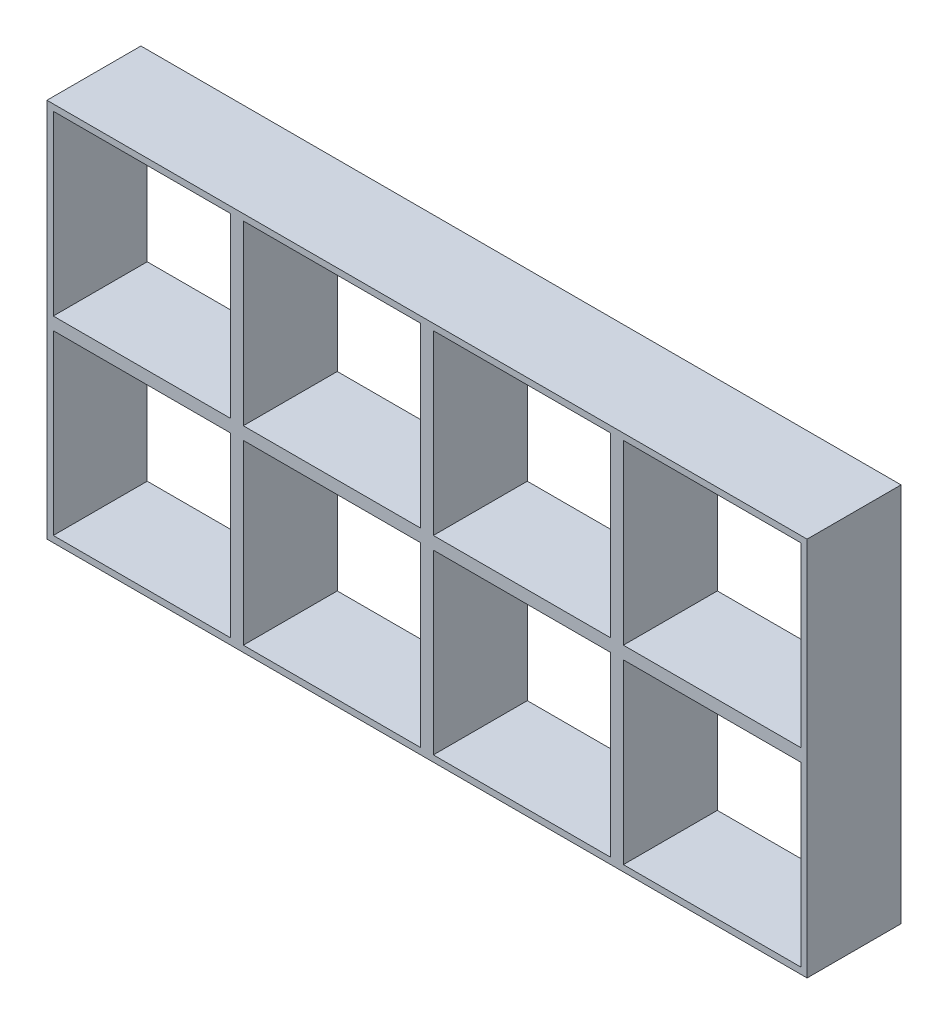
SolidWorks part; units mm, degrees
ref_plane "Plan de face" through (0, 0, 0) normal (0, 0, 1) x (1, 0, 0)
ref_plane "Plan de dessus" through (0, 0, 0) normal (0, 1, 0) x (1, 0, 0)
ref_plane "Plan de droite" through (0, 0, 0) normal (1, 0, 0) x (0, 0, -1)
sketch "Esquisse1" plane through (0, 0, 0) normal (0, 0, 1) x (1, 0, 0)
  line L0 (0, 0) -> (0, 30)
  line L16 (59, 1) -> (59, 29)
  line L17 (59, 29) -> (31, 29)
  line L18 (31, 29) -> (31, 1)
  line L20 (29, 1) -> (29, 29)
  line L21 (29, 29) -> (1, 29)
  line L22 (1, 29) -> (1, 1)
  line L24 (0, 30) -> (120, 30)
  line L25 (60, 30) -> (60, 1) construction
  line L27 (119, 29) -> (119, 1)
  line L28 (91, 29) -> (119, 29)
  line L29 (91, 1) -> (91, 29)
  line L31 (89, 29) -> (89, 1)
  line L32 (61, 29) -> (89, 29)
  line L33 (61, 1) -> (61, 29)
  line L34 (120, 0) -> (120, 30)
  line L35 (0, 0) -> (120, 0)
  line L36 (1, 1) -> (29, 1)
  line L37 (29, 29) -> (31, 29) construction
  line L38 (59, 29) -> (61, 29) construction
  line L39 (89, 29) -> (91, 29) construction
  line L41 (119, 1) -> (120, 1) construction
  line L42 (91, 1) -> (119, 1)
  line L43 (61, 1) -> (89, 1)
  line L44 (31, 1) -> (59, 1)
  dimension "D1" = 1
  dimension "D2" = 1
  dimension "D3" = 2
  dimension "D4" = 30
  dimension "D5" = 1
  dimension "D6" = 28
  dimension "D7" = 28
extrude "Boss.-Extru.1" add sketch "Esquisse1" along normal blind 14.8333 contours L0 L35 L34 L24 L44 L18 L17 L16 L43 L33 L32 L31 L42 L29 L28 L27 L36 L22 L21 L20
mirror "Symétrie1" about plane through (0, 0, 14.8333) normal (0, 1, 0) of "Boss.-Extru.1"
